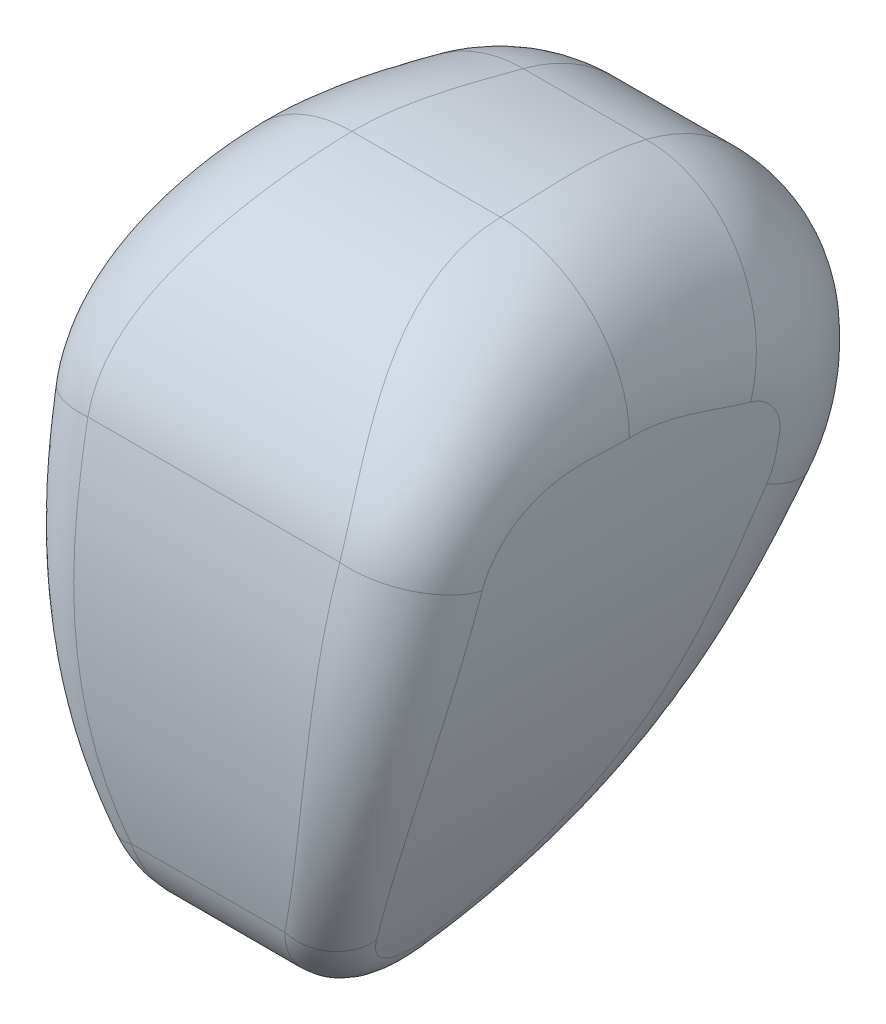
SolidWorks part; units mm, degrees
ref_plane "XY" through (0, 0, 0) normal (0, 0, 1) x (1, 0, 0)
ref_plane "YZ" through (0, 0, 0) normal (0, 1, 0) x (1, 0, 0)
ref_plane "XZ" through (0, 0, 0) normal (1, 0, 0) x (0, 0, -1)
sketch "Sketch9" plane through (0, 0, 0) normal (1, 0, 0) x (0, 0, -1)
  line L0 (-45.1744, 365.7052) -> (6.1106, 476.3141) construction
  line L1 (-45.1744, 365.7052) -> (51.2227, 483.7448) construction
  line L2 (6.1106, 476.3141) -> (51.2227, 483.7448) construction
  line L3 (0, 116.037) -> (0, -116.037) construction
  arc A0 (4.5333, 570.2809) -> (-84.8187, 500.0652) centre (6.1106, 476.3141) ccw
  arc A1 (121.74, 443.3253) -> (71.1881, 562.5345) centre (51.2227, 483.7448) ccw
  arc A2 (-87.3049, 356.243) -> (-34.2264, 323.9361) centre (-45.1744, 365.7052) ccw
  arc A3 (4.5333, 570.2809) -> (71.1881, 562.5345) centre (8.7962, 316.3166) cw
  arc A4 (121.74, 443.3253) -> (-34.2264, 323.9361) centre (-98.6267, 569.6363) cw
  arc A5 (-87.3049, 356.243) -> (-84.8187, 500.0652) centre (210.0869, 423.0346) cw
  dimension "D4" = 93.98
  dimension "D5" = 81.28
  dimension "D6" = 254
  dimension "D7" = 254
  dimension "D8" = 304.8
  dimension "D9" = 43.18
  dimension "D1" = 45.72
  dimension "D2" = 152.4
  dimension "D3" = 121.92
  dimension "D12" = 39.237
extrude "Base-Extrude" add sketch "Sketch9" along normal mid plane 208.28
sketch "Sketch10" plane through (0, 0, 0) normal (1, 0, 0) x (0, 0, -1)
  circle A0 centre (38.554, 379.3379) radius 3.805
extrude "Cut-Extrude1" cut sketch "Sketch10" against normal mid plane 25.4
sketch "Sketch11" plane through (0, 0, 0) normal (0, 0, 1) x (1, 0, 0)
  arc A0 (80.9975, 581.0435) -> (21.292, 293.0524) centre (-367.3168, 523.8022) cw
extrude "Cut-Extrude2" cut sketch "Sketch11" against normal through all and the other way through all
fillet "VarFillet1" radius 20.32 12 edges at (-10.5828, 562.5345, -71.1881) (-13.3629, 443.3253, -121.74) (84.6335, 522.0063, -122.9339) (-33.049, 323.9361, 34.2264) (-25.8557, 356.243, 87.3049) (-10.0634, 500.0652, 84.8187) (-10.9496, 570.2809, -4.5333) (83.9451, 548.8016, 53.7042) (70.7808, 412.7493, 94.5395) (41.3343, 330.7566, 70.5341) (53.5434, 359.0631, -43.4116)
mirror "Mirror2" about plane through (0, 0, 0) normal (1, 0, 0) of "VarFillet1", "Cut-Extrude2"
